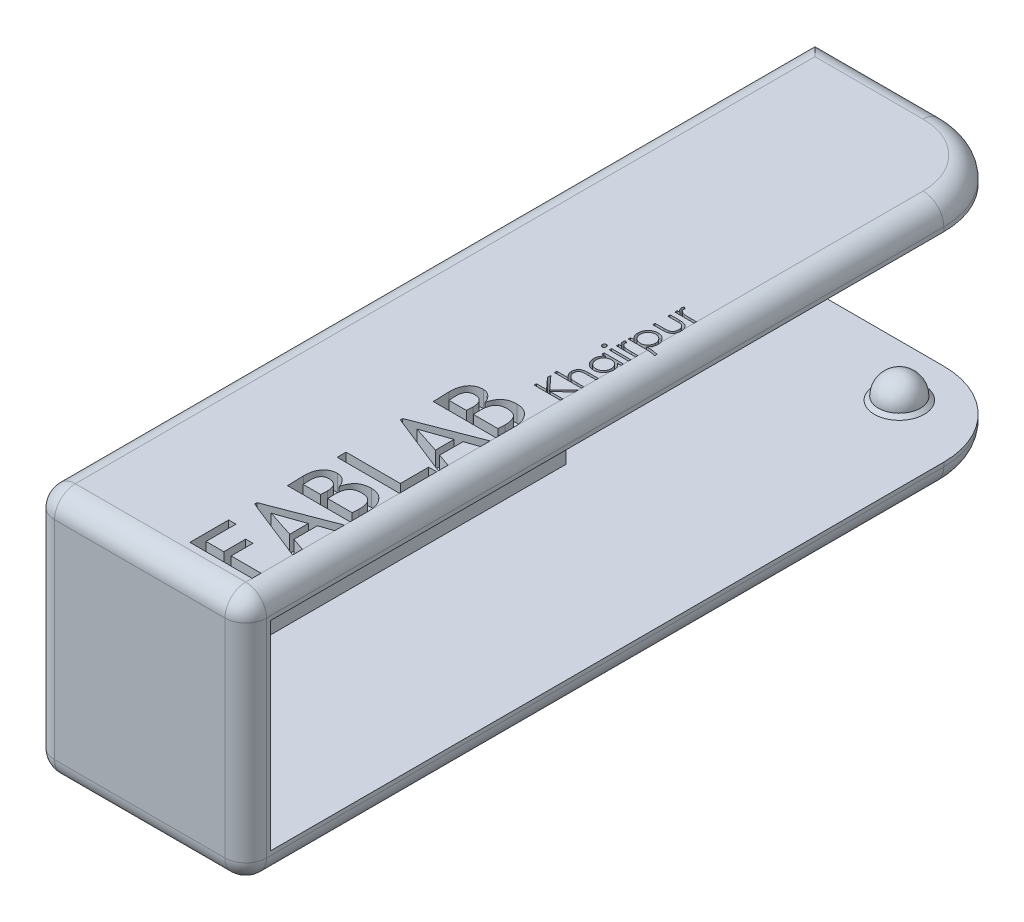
SolidWorks part; units mm, degrees
ref_plane "Front Plane" through (0, 0, 0) normal (0, 0, 1) x (1, 0, 0)
ref_plane "Top Plane" through (0, 0, 0) normal (0, 1, 0) x (1, 0, 0)
ref_plane "Right Plane" through (0, 0, 0) normal (1, 0, 0) x (0, 0, -1)
sketch "Sketch9" plane through (0, 0, 0) normal (0, 0, 1) x (1, 0, 0)
  line L1 (0, 0) -> (22.5, 0)
  line L2 (0, 0) -> (0, 24)
  line L3 (0, 24) -> (22.5, 24)
  line L4 (22.5, 0) -> (22.5, 24)
  dimension "D1" = 22.5
  dimension "D2" = 24
extrude "Extrude-Thin5" add sketch "Sketch9" against normal blind 91 thin
sketch "Sketch10" plane through (0, 0, 0) normal (0, 0, 1) x (1, 0, 0)
  line L1 (-3, 27) -> (25.5, 27)
  line L2 (-3, 27) -> (-3, -3)
  line L3 (-3, -3) -> (25.5, -3)
  line L4 (25.5, 27) -> (25.5, -3)
extrude "Boss-Extrude3" add sketch "Sketch10" along normal blind 3
sketch "Sketch14" plane through (25.5, 0, 0) normal (1, 0, 0) x (0, 0, -1)
  line L1 (-3, 27) -> (91, 27)
  line L2 (-3, 27) -> (-3, -3)
  line L3 (-3, -3) -> (91, -3)
  line L4 (91, 27) -> (91, -3)
extrude "Cut-Extrude6" cut sketch "Sketch14" against normal blind 3
sketch "Sketch16" plane through (0, 0, 0) normal (1, 0, 0) x (0, 0, -1)
  line L0 (91, 0) -> (0, 0) construction
  line L1 (91, 24) -> (58.036, 24)
  line L2 (91, 24) -> (91, 0)
  line L3 (91, 0) -> (58.036, 0)
  line L4 (58.036, 24) -> (58.036, 0)
extrude "Cut-Extrude8" cut sketch "Sketch16" against normal blind 3
sketch "Sketch17" plane through (0, 0, 0) normal (0, 1, 0) x (1, 0, 0)
  line L0 (4.2, 91) -> (22.5, 78.6) construction
  line L1 (22.5, 91) -> (4.2, 91)
  line L2 (22.5, 91) -> (22.5, 78.6)
  line L3 (22.5, 78.6) -> (4.2, 78.6)
  line L4 (4.2, 91) -> (4.2, 78.6)
  circle A0 centre (13.35, 84.8) radius 3
  dimension "D4" = 6
  dimension "D1" = 12.4
  dimension "D2" = 18.3
sketch "Sketch35" plane through (0, 24, 0) normal (0, -1, 0) x (1, 0, 0)
  line L0 (4.2, -91) -> (22.5, -78.6) construction
  line L1 (22.5, -91) -> (4.2, -91)
  line L2 (22.5, -91) -> (22.5, -78.6)
  line L3 (22.5, -78.6) -> (4.2, -78.6)
  line L4 (4.2, -91) -> (4.2, -78.6)
  line L5 (22.5, -91) -> (4.2, -78.6) construction
  circle A0 centre (13.35, -84.8) radius 3
  dimension "D3" = 6
  dimension "D1" = 12.4
  dimension "D2" = 18.3
extrude "Boss-Extrude12" add sketch "Sketch35" along normal blind 0.4 draft 50 contours A0
sketch "Sketch36" plane through (0, 23.6, 0) normal (0, -1, 0) x (1, 0, 0)
  line L0 (13.35, -87.3233) -> (13.35, -82.2767)
  circle A0 centre (13.35, -84.8) radius 2.5233 construction
  arc A1 (13.35, -87.3233) -> (13.35, -82.2767) centre (13.35, -84.8) cw
revolve "Revolve6" add sketch "Sketch36" angle 180 about L0
sketch "Sketch38" plane through (0, 24, 0) normal (0, -1, 0) x (1, 0, 0)
  line L1 (22.5, 0) -> (8, 0)
  line L2 (22.5, 0) -> (22.5, -17.4)
  line L3 (22.5, -17.4) -> (8, -17.4)
  line L4 (8, 0) -> (8, -17.4)
  line L5 (8, -17.4) -> (22.5, 0) construction
  line L6 (15.25, -8.7) -> (8, -8.7) construction
  line L7 (15.25, -8.7) -> (15.25, 0) construction
  line L13 (15.25, -8.7) -> (22.5, -8.7) construction
  line L14 (22.5, -8.7) -> (15.25, 0) construction
  line L15 (18.875, -4.35) -> (15.25, -4.35) construction
  line L16 (18.875, -4.35) -> (18.875, 0) construction
  line L17 (18.875, 0) -> (15.25, -4.35) construction
  line L18 (18.0807, -0.9531) -> (16.0443, -3.3969)
  arc A1 (16.0443, -3.3969) -> (18.0807, -0.9531) centre (17.0625, -2.175) cw
  dimension "D1" = 17.4
  dimension "D2" = 14.5
fillet "Fillet5" radius 10 2 edges at (22.5, -1.5, -91) (22.5, 25.5, -91)
fillet "Fillet6" radius 2.5 13 edges at (-3, 12, 3) (9.75, -3, 3) (9.75, 27, 3) (22.5, 12, 3) (22.5, -3, -39) (-3, 27, -44) (-3, -3, -44) (-3, 12, -58.036) (4.75, -3, -91) (22.5, 27, -39) (19.5711, -3, -88.0711) (4.75, 27, -91) (19.5711, 27, -88.0711)
revolve "Cut-Revolve12" cut sketch "Sketch38" angle 180 about L18
sketch "Sketch39" plane through (0, 27, 0) normal (0, 1, 0) x (1, 0, 0)
  line L0 (20, -0.5) -> (20, 81) construction
  text T0 "FABLAB  " font "Trebuchet MS" height 7.5
  text T1 "         Khairpur"
extrude "Cut-Extrude12" cut sketch "Sketch39" against normal blind 2
extrude "Boss-Extrude13" add sketch "Sketch17" along normal blind 0.4 draft 50 contours A0 L0 | L0 A0
sketch "Sketch40" plane through (0, 0.4, 0) normal (0, 1, 0) x (1, 0, 0)
  line L0 (13.35, 82.2767) -> (13.35, 87.3233) construction
  line L1 (13.35, 87.3233) -> (13.35, 82.2767)
  circle A0 centre (13.35, 84.8) radius 2.5233 construction
  arc A1 (13.35, 87.3233) -> (13.35, 82.2767) centre (13.35, 84.8) cw
revolve "Revolve8" add sketch "Sketch40" angle 180 about L0
